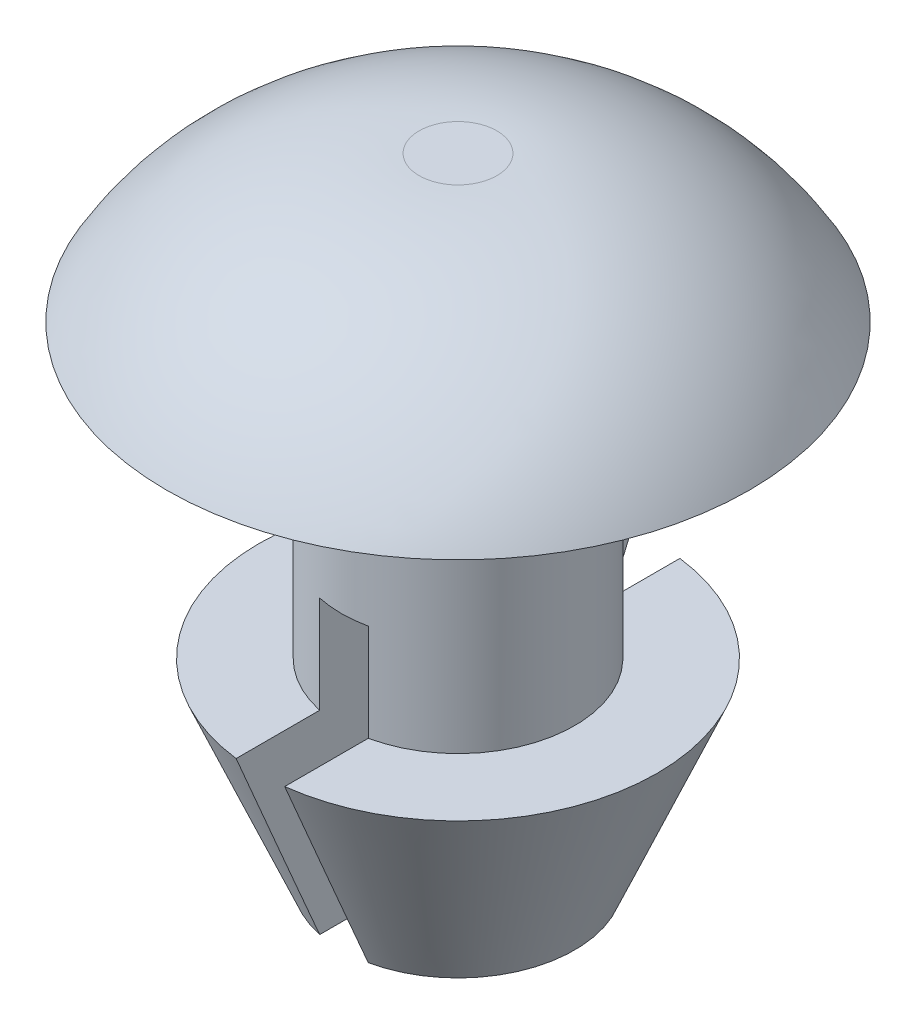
SolidWorks part; units mm, degrees
ref_plane "Front Plane" through (0, 0, 0) normal (0, 0, 1) x (1, 0, 0)
ref_plane "Top Plane" through (0, 0, 0) normal (0, 1, 0) x (1, 0, 0)
ref_plane "Right Plane" through (0, 0, 0) normal (1, 0, 0) x (0, 0, -1)
sketch "Sketch1" plane through (0, 0, 0) normal (0, 1, 0) x (1, 0, 0)
  circle A0 centre (0, 0) radius 1.524
  dimension "D1" = 3.048
extrude "Boss-Extrude1" add sketch "Sketch1" along normal blind 6.35
sketch "Sketch2" plane through (0, 0, 0) normal (0, -1, 0) x (1, 0, 0)
  circle A0 centre (0, 0) radius 1.524
  circle A1 centre (0, 0) radius 1.524 construction
extrude "Boss-Extrude2" add sketch "Sketch2" against normal blind 2.54 draft 23
sketch "Sketch3" plane through (0, 0, 0) normal (0, -1, 0) x (1, 0, 0)
  line L1 (-0.3175, 8.1828) -> (0.3175, 8.1828)
  line L2 (-0.3175, 8.1828) -> (-0.3175, -8.1828)
  line L3 (-0.3175, -8.1828) -> (0.3175, -8.1828)
  line L4 (0.3175, 8.1828) -> (0.3175, -8.1828)
  point P4 (0, -8.1828)
  point P8 (-0.3175, 0)
  dimension "D1" = 0.635
extrude "Cut-Extrude1" cut sketch "Sketch3" against normal offset from surface (3.81 mm away) 2.54
sketch "Sketch4" plane through (0, 0, 0) normal (0, 0, 1) x (1, 0, 0)
  line L0 (0, 0) -> (0, 19.0719) construction
  line L1 (0, 6.35) -> (3.81, 6.35)
  line L3 (1.524, 6.35) -> (-1.524, 6.35) construction
  line L4 (0, 6.35) -> (0, 8.2592)
  line L5 (0, 8.2592) -> (0.508, 8.2592)
  arc A1 (0.508, 8.2592) -> (3.81, 6.35) centre (0.508, 4.4492) cw
  dimension "D2" = 3.81
  dimension "D1" = 3.81
  dimension "D3" = 0
  dimension "D4" = 0.508
revolve "Revolve1" add sketch "Sketch4" angle 360 about L0
